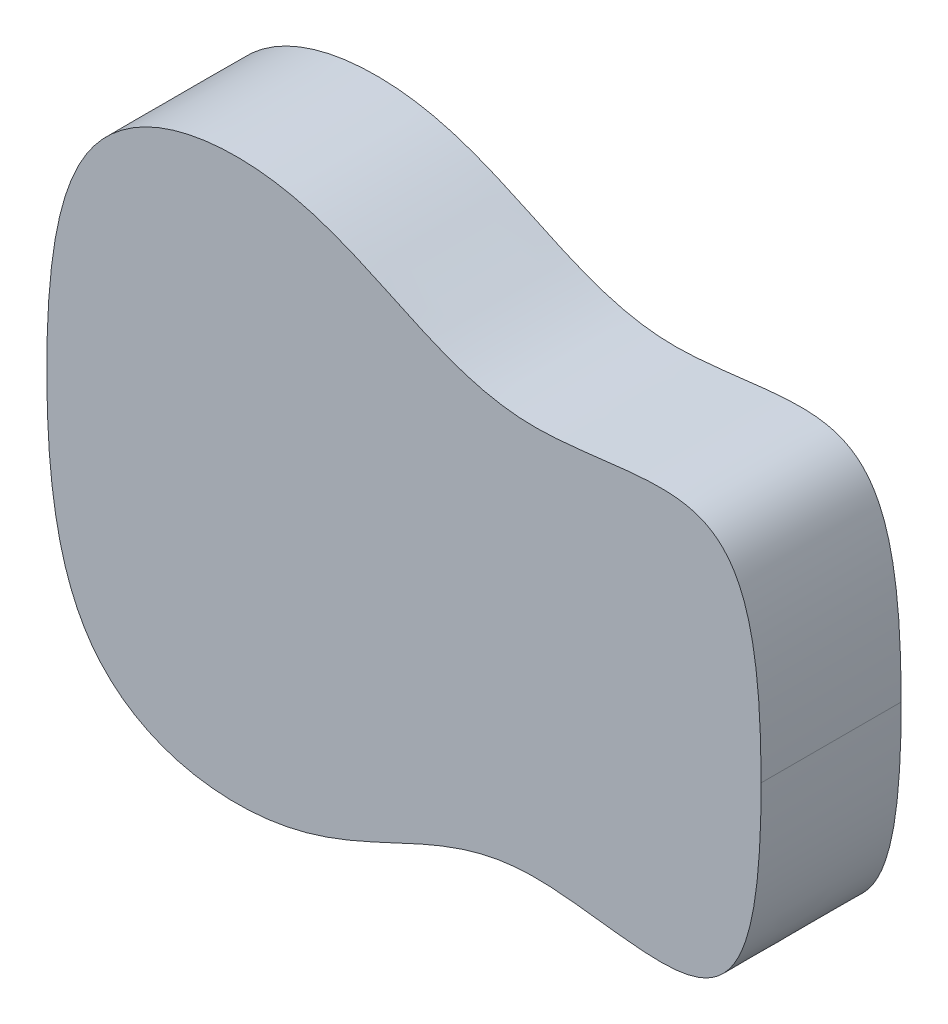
SolidWorks part; units mm, degrees
ref_plane "Front Plane" through (0, 0, 0) normal (0, 0, 1) x (1, 0, 0)
ref_plane "Top Plane" through (0, 0, 0) normal (0, 1, 0) x (1, 0, 0)
ref_plane "Right Plane" through (0, 0, 0) normal (1, 0, 0) x (0, 0, -1)
sketch "Picture" plane through (0, 0, 0) normal (0, 0, 1) x (1, 0, 0)
  line L0 (0.329, -0.9612) -> (510.329, -0.9612) construction
  dimension "D1" = 510
sketch "Sketch2" plane through (0, 0, 0) normal (0, 0, 1) x (1, 0, 0)
  line L0 (0, 0) -> (510, 0) construction
  line L1 (0, 150.0299) -> (0, -151.6212) construction
  line L2 (510, -90.6602) -> (510, 92.3002) construction
  spline S0 degree 3 poles (0, 0) (0, 71.6691) (21.885, 187.667) (201.9104, 219.6793) (295.6018, 117.8797) (475.2938, 163.0116) (510, 115.0185) (510, 0) knots 0 0 0 0 0.130854 0.316704 0.624722 0.773547 1 1 1 1
  spline S1 degree 3 poles (0, 0) (0, -71.6691) (21.885, -187.667) (201.9104, -219.6793) (295.6018, -117.8797) (475.2938, -163.0116) (510, -115.0185) (510, 0) knots 0 0 0 0 0.130854 0.316704 0.624722 0.773547 1 1 1 1
  dimension "D1" = 510
extrude "Boss-Extrude1" add sketch "Sketch2" along normal blind 100
